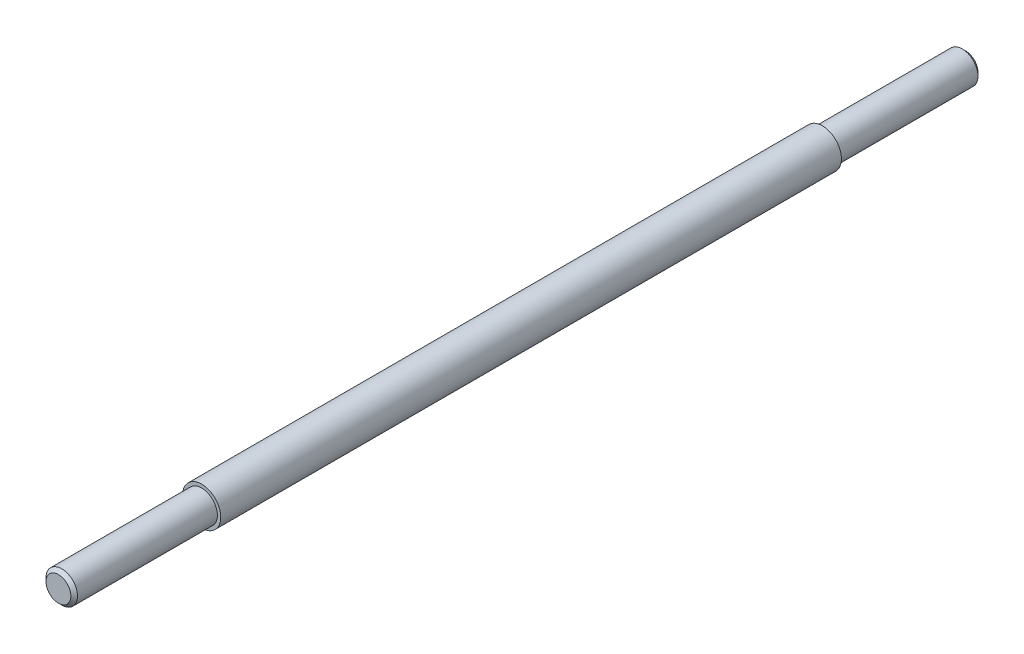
SolidWorks part; units mm, degrees
ref_plane "Front Plane" through (0, 0, 0) normal (0, 0, 1) x (1, 0, 0)
ref_plane "Top Plane" through (0, 0, 0) normal (0, 1, 0) x (1, 0, 0)
ref_plane "Right Plane" through (0, 0, 0) normal (1, 0, 0) x (0, 0, -1)
sketch "Sketch1" plane through (0, 0, 0) normal (0, 0, 1) x (1, 0, 0)
  circle A0 centre (0, 0) radius 2
  dimension "D1" = 4
extrude "Extrude1" add sketch "Sketch1" along normal blind 95
sketch "Sketch2" plane through (0, 0, 95) normal (0, 0, 1) x (1, 0, 0)
  circle A0 centre (0, 0) radius 4.5779
  circle A1 centre (0, 0) radius 1.65
  dimension "D1" = 3.3
extrude "Extrude2" cut sketch "Sketch2" against normal blind 15
sketch "Sketch3" plane through (0, 0, 0) normal (0, 0, -1) x (-1, 0, 0)
  circle A0 centre (0, 0) radius 1.65
  circle A1 centre (0, 0) radius 4.7721
  dimension "D1" = 3.3
extrude "Extrude3" cut sketch "Sketch3" against normal blind 15
chamfer "Chamfer1" distance 0.35 angle 45 2 edges at (1.65, 0, 95) (-1.65, 0, 0)
